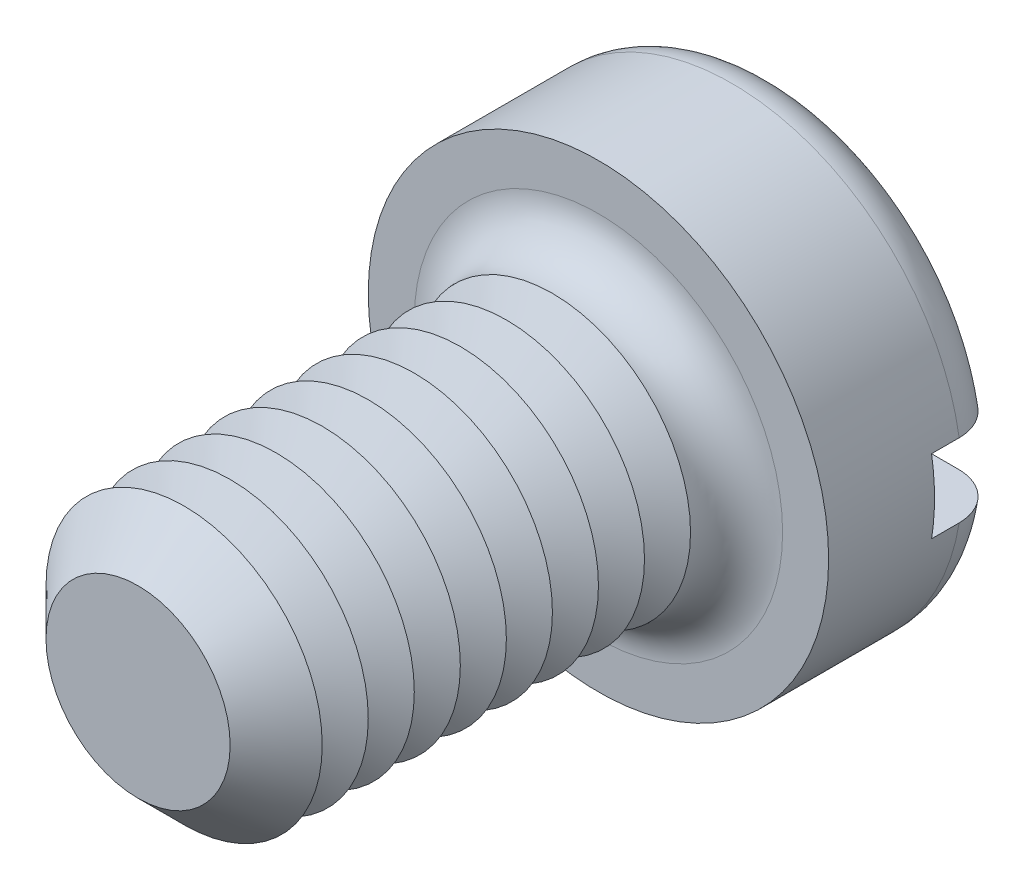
SolidWorks part; units mm, degrees
ref_plane "Front Plane" through (0, 0, 0) normal (0, 0, 1) x (1, 0, 0)
ref_plane "Top Plane" through (0, 0, 0) normal (0, 1, 0) x (1, 0, 0)
ref_plane "Right Plane" through (0, 0, 0) normal (1, 0, 0) x (0, 0, -1)
sketch "Sketch3" plane through (0, 0, 0) normal (0, 0, 1) x (1, 0, 0)
  circle A0 centre (0, 0) radius 5
  dimension "D1" = 10
extrude "Boss-Extrude2" add sketch "Sketch3" against normal blind 3.9
sketch "Sketch4" plane through (0, 0, 0) normal (0, 0, 1) x (1, 0, 0)
  circle A0 centre (0, 0) radius 3
  dimension "D1" = 6
extrude "Boss-Extrude3" add sketch "Sketch4" along normal blind 10
fillet "Fillet1" radius 1 2 edges at (5, 0, -3.9) (3, 0, 0)
chamfer "Chamfer1" distance 1 angle 45 1 edges at (3, 0, 10)
sketch "Sketch5" plane through (0, 0, 0) normal (1, 0, 0) x (0, 0, -1)
  line L0 (1.6944, 0) -> (-7.6738, 0) construction
sketch "Sketch6" plane through (0, 0, 0) normal (1, 0, 0) x (0, 0, -1)
  line L0 (-1, 3) -> (-1.5, 2.134)
  line L1 (-1.5, 2.134) -> (-2, 3)
  line L2 (-1, 3) -> (-9, 3) construction
  line L3 (-2, 3) -> (-1, 3)
  dimension "D1" = 1
revolve "Cut-Revolve1" cut sketch "Sketch6" angle 360 about L0
pattern_linear "LPattern1" count 8 spacing 1 along (0, 0, 1) of "Cut-Revolve1"
sketch "Sketch8" plane through (0, 0, -3.9) normal (0, 0, -1) x (-1, 0, 0)
  line L1 (5, -0.8) -> (-5, -0.8)
  line L2 (5, -0.8) -> (5, 0.8)
  line L3 (5, 0.8) -> (-5, 0.8)
  line L4 (-5, -0.8) -> (-5, 0.8)
  line L5 (5, -0.8) -> (-5, 0.8) construction
  line L6 (5, 0.8) -> (-5, -0.8) construction
  point P0 (0, 0)
  dimension "D1" = 10
  dimension "D2" = 1.6
extrude "Cut-Extrude1" cut sketch "Sketch8" against normal blind 1.6
